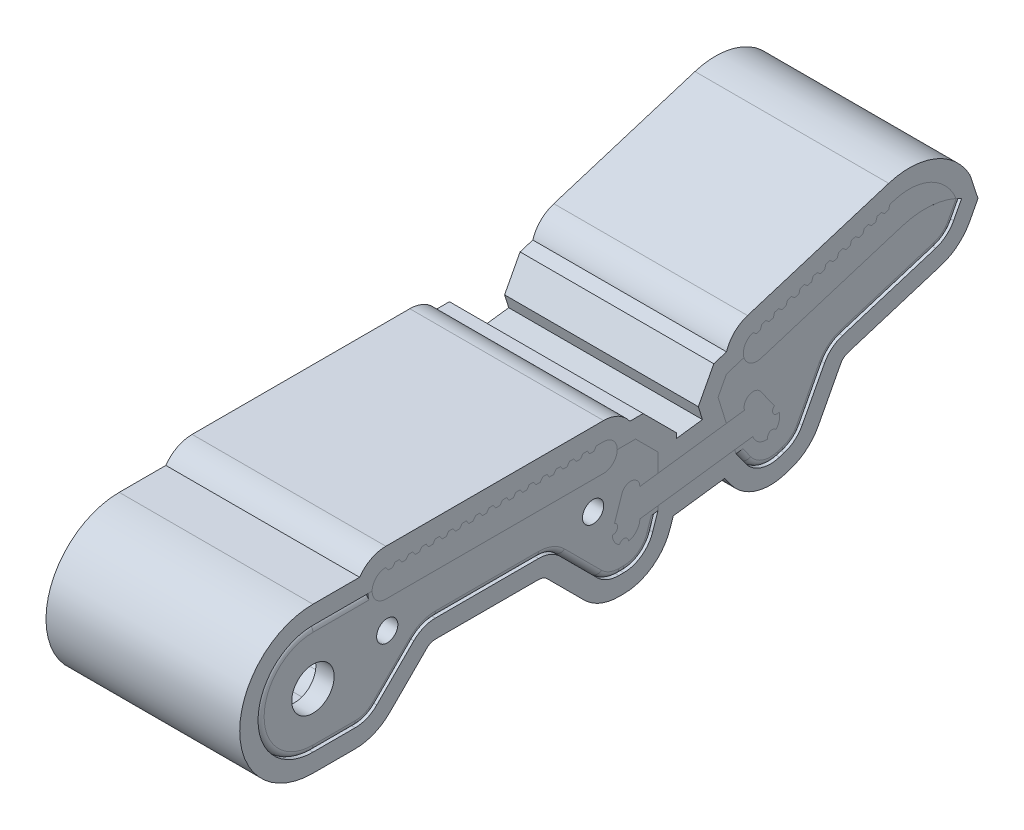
SolidWorks part; units mm, degrees
other "<finger_pivot>-<Wall Removal[2]>"
other "<finger_pivot>-<Wall Removal[1]>"
other "<finger_pivot>-<Pad Material[3]>"
other "<finger_pivot>-<Pad Material[2]>"
other "<finger_pivot>-<Pad Material[1]>"
ref_plane "Front Plane" through (0, 0, 0) normal (0, 0, 1) x (1, 0, 0)
ref_plane "Top Plane" through (0, 0, 0) normal (0, 1, 0) x (1, 0, 0)
ref_plane "Right Plane" through (0, 0, 0) normal (1, 0, 0) x (0, 0, -1)
inserted part "finger_pivot"
sketch "Sketch1" plane through (15.875, 0, 0) normal (1, 0, 0) x (0, 0, -1)
  line L0 (71.2277, 17.3552) -> (94.3613, 24.5492)
  line L1 (11.95, 14.25) -> (47.6241, 14.25)
  line L2 (107.6723, 19.1049) -> (108.9953, 15.0907)
  line L3 (106.3109, 16.4315) -> (108.9953, 15.0907) construction
  line L4 (108.9953, 15.0907) -> (107.6539, 12.5385)
  line L46 (73.4548, 10.1935) -> (96.5884, 17.3875)
  line L47 (95.2522, 21.6845) -> (94.5585, 21.4688)
  line L48 (94.5585, 21.4688) -> (94.3471, 20.8015)
  line L49 (94.3471, 20.8015) -> (93.6787, 20.5936)
  line L50 (93.6787, 20.5936) -> (93.1262, 21.0234)
  line L51 (93.1262, 21.0234) -> (92.4577, 20.8155)
  line L52 (92.4577, 20.8155) -> (92.2464, 20.1482)
  line L53 (92.2464, 20.1482) -> (91.5779, 19.9403)
  line L54 (91.5779, 19.9403) -> (91.0254, 20.3701)
  line L55 (91.0254, 20.3701) -> (90.357, 20.1622)
  line L56 (90.357, 20.1622) -> (90.1456, 19.4949)
  line L57 (90.1456, 19.4949) -> (89.4772, 19.2871)
  line L58 (89.4772, 19.2871) -> (88.9246, 19.7168)
  line L59 (7.6416, 12) -> (7.6416, 12)
  line L60 (88.9246, 19.7168) -> (88.2562, 19.509)
  line L61 (88.2562, 19.509) -> (88.0448, 18.8416)
  line L62 (88.0448, 18.8416) -> (87.3764, 18.6338)
  line L63 (87.3764, 18.6338) -> (86.8239, 19.0635)
  line L64 (86.8239, 19.0635) -> (86.1554, 18.8557)
  line L65 (56.5464, -3.0058) -> (56.5464, -2.2998) construction
  line L66 (7.6416, 12) -> (0, 12)
  line L67 (0, -12) -> (6.9289, -12)
  line L68 (12.5858, -9.6569) -> (18.6569, -3.5858)
  line L69 (56.5464, 2.2998) -> (56.5464, 5.3277) construction
  line L70 (56.5464, 5.3277) -> (52.8741, 9) construction
  line L71 (52.8741, 9) -> (49.8741, 9) construction
  line L72 (20.0711, -3) -> (36.9754, -3)
  line L73 (9.7, 9) -> (9, 9) construction
  line L74 (38.3896, -3.5858) -> (44.4606, -9.6569)
  line L75 (9, 9) -> (0, 9) construction
  line L76 (0, -9) -> (6.9289, -9) construction
  line L77 (10.4645, -7.5355) -> (16.5355, -1.4645) construction
  line L78 (20.0711, 0) -> (36.9754, 0) construction
  line L79 (40.5109, -1.4645) -> (46.582, -7.5355) construction
  line L80 (50.1175, -9) -> (50.9402, -9) construction
  line L81 (50.1175, -12) -> (50.9402, -12)
  line L82 (55.6812, -5.5884) -> (56.5464, -3.0058) construction
  line L83 (58.5258, -6.5414) -> (59.0432, -4.997)
  line L84 (70.731, 4.1672) -> (53.5721, 1.9082) construction
  line L85 (59.0432, -4.997) -> (59.0432, -4.997)
  line L86 (53.5721, -2.6914) -> (72.1051, -0.2514) construction
  line L87 (69.1308, -0.643) -> (69.3417, -1.3213) construction
  line L88 (59.0432, -4.997) -> (67.4895, -3.885)
  line L89 (105.4161, 16.8784) -> (105.4064, 16.8833) construction
  line L90 (67.4895, -3.885) -> (67.4895, -3.885)
  line L91 (70.6381, 11.6739) -> (67.7735, 10.783) construction
  line L92 (67.7735, 10.783) -> (66.3939, 8.1581) construction
  line L93 (66.3939, 8.1581) -> (67.7567, 3.7756) construction
  line L94 (67.4895, -3.885) -> (68.4762, -5.2588)
  line L95 (77.3495, -8.2311) -> (78.1282, -7.9889)
  line L96 (82.8341, -4.0717) -> (86.4934, 2.8908)
  line L97 (87.6699, 3.8701) -> (102.9481, 8.6213)
  line L98 (86.1554, 18.8557) -> (85.9441, 18.1883)
  line L99 (85.9441, 18.1883) -> (85.2756, 17.9805)
  line L100 (85.2756, 17.9805) -> (84.7231, 18.4102)
  line L101 (84.7231, 18.4102) -> (84.0547, 18.2024)
  line L102 (84.0547, 18.2024) -> (83.8433, 17.5351)
  line L103 (83.8433, 17.5351) -> (83.1749, 17.3272)
  line L104 (83.1749, 17.3272) -> (82.6223, 17.757)
  line L105 (82.6223, 17.757) -> (81.9539, 17.5491)
  line L106 (81.9539, 17.5491) -> (81.7425, 16.8818)
  line L107 (81.7425, 16.8818) -> (81.0741, 16.6739)
  line L108 (81.0741, 16.6739) -> (80.5216, 17.1037)
  line L109 (80.5216, 17.1037) -> (79.8531, 16.8958)
  line L110 (79.8531, 16.8958) -> (79.6418, 16.2285)
  line L111 (79.6418, 16.2285) -> (78.9733, 16.0206)
  line L112 (78.9733, 16.0206) -> (78.4208, 16.4504)
  line L113 (78.4208, 16.4504) -> (77.7524, 16.2425)
  line L114 (77.7524, 16.2425) -> (77.541, 15.5752)
  line L115 (77.541, 15.5752) -> (76.8726, 15.3673)
  line L116 (76.8726, 15.3673) -> (76.32, 15.7971)
  line L117 (76.32, 15.7971) -> (75.6516, 15.5892)
  line L118 (75.6516, 15.5892) -> (75.4402, 14.9219)
  line L119 (75.4402, 14.9219) -> (74.7718, 14.714)
  line L120 (74.7718, 14.714) -> (74.2193, 15.1438)
  line L121 (74.2193, 15.1438) -> (73.5509, 14.9359)
  line L122 (73.5509, 14.9359) -> (73.3395, 14.2686)
  line L123 (73.3395, 14.2686) -> (72.6711, 14.0607)
  line L124 (72.6711, 14.0607) -> (72.1185, 14.4905)
  line L126 (95.2522, 21.6845) -> (94.5585, 21.4688)
  line L127 (94.5585, 21.4688) -> (94.3471, 20.8015)
  line L128 (94.3471, 20.8015) -> (93.6787, 20.5936)
  line L129 (93.6787, 20.5936) -> (93.1262, 21.0234)
  line L130 (93.1262, 21.0234) -> (92.4577, 20.8155)
  line L131 (92.4577, 20.8155) -> (92.2464, 20.1482)
  line L132 (92.2464, 20.1482) -> (91.5779, 19.9403)
  line L133 (91.5779, 19.9403) -> (91.0254, 20.3701)
  line L134 (91.0254, 20.3701) -> (90.357, 20.1622)
  line L135 (90.357, 20.1622) -> (90.1456, 19.4949)
  line L136 (90.1456, 19.4949) -> (89.4772, 19.2871)
  line L137 (89.4772, 19.2871) -> (88.9246, 19.7168)
  line L138 (88.9246, 19.7168) -> (88.2562, 19.509)
  line L139 (88.2562, 19.509) -> (88.0448, 18.8416)
  line L140 (88.0448, 18.8416) -> (87.3764, 18.6338)
  line L141 (87.3764, 18.6338) -> (86.8239, 19.0635)
  line L142 (106.3109, 16.4315) -> (105.4161, 16.8784) construction
  line L143 (104.9984, 13.9342) -> (106.3109, 16.4315) construction
  line L144 (86.779, 6.7348) -> (102.0572, 11.486) construction
  line L146 (69.3417, -1.3213) -> (70.9128, -3.5087) construction
  line L147 (76.4586, -5.3664) -> (77.2373, -5.1242) construction
  line L148 (80.1785, -2.6759) -> (83.8378, 4.2865) construction
  line L150 (107.6723, 19.1049) -> (107.6723, 19.1049)
  line L151 (67.7817, 13.9273) -> (65.696, 13.2787)
  line L152 (65.696, 13.2787) -> (63.1602, 8.4538)
  line L153 (63.1602, 8.4538) -> (63.8346, 6.2852)
  line L154 (63.8346, 6.2852) -> (59.5464, 5.7206)
  line L155 (59.5464, 5.7206) -> (59.5464, 6.5703)
  line L156 (59.5464, 6.5703) -> (54.1167, 12)
  line L157 (54.1167, 12) -> (51.9325, 12)
  line L158 (86.8239, 19.0635) -> (86.1554, 18.8557)
  line L159 (86.1554, 18.8557) -> (85.9441, 18.1883)
  line L160 (85.9441, 18.1883) -> (85.2756, 17.9805)
  line L161 (85.2756, 17.9805) -> (84.7231, 18.4102)
  line L162 (84.7231, 18.4102) -> (84.0547, 18.2024)
  line L163 (84.0547, 18.2024) -> (83.8433, 17.5351)
  line L164 (83.8433, 17.5351) -> (83.1749, 17.3272)
  line L165 (83.1749, 17.3272) -> (82.6223, 17.757)
  line L166 (82.6223, 17.757) -> (81.9539, 17.5491)
  line L167 (81.9539, 17.5491) -> (81.7425, 16.8818)
  line L168 (81.7425, 16.8818) -> (81.0741, 16.6739)
  line L169 (81.0741, 16.6739) -> (80.5216, 17.1037)
  line L170 (80.5216, 17.1037) -> (79.8531, 16.8958)
  line L171 (79.8531, 16.8958) -> (79.6418, 16.2285)
  line L172 (79.6418, 16.2285) -> (78.9733, 16.0206)
  line L173 (78.9733, 16.0206) -> (78.4208, 16.4504)
  line L174 (78.4208, 16.4504) -> (77.7524, 16.2425)
  line L175 (77.7524, 16.2425) -> (77.541, 15.5752)
  line L176 (77.541, 15.5752) -> (76.8726, 15.3673)
  line L177 (76.8726, 15.3673) -> (76.32, 15.7971)
  line L178 (76.32, 15.7971) -> (75.6516, 15.5892)
  line L179 (75.6516, 15.5892) -> (75.4402, 14.9219)
  line L180 (75.4402, 14.9219) -> (74.7718, 14.714)
  line L181 (74.7718, 14.714) -> (74.2193, 15.1438)
  line L182 (74.2193, 15.1438) -> (73.5509, 14.9359)
  line L183 (73.5509, 14.9359) -> (73.3395, 14.2686)
  line L184 (73.3395, 14.2686) -> (72.6711, 14.0607)
  line L185 (72.6711, 14.0607) -> (72.1185, 14.4905)
  line L206 (44.25, 11.25) -> (43.85, 10.6755)
  line L207 (43.85, 10.6755) -> (43.15, 10.6755)
  line L208 (43.15, 10.6755) -> (42.75, 11.25)
  line L209 (42.75, 11.25) -> (42.05, 11.25)
  line L210 (42.05, 11.25) -> (41.65, 10.6755)
  line L211 (41.65, 10.6755) -> (40.95, 10.6755)
  line L212 (40.95, 10.6755) -> (40.55, 11.25)
  line L213 (40.55, 11.25) -> (39.85, 11.25)
  line L214 (56.5464, -3.0058) -> (56.5464, -2.2998)
  line L215 (39.85, 11.25) -> (39.45, 10.6755)
  line L216 (39.45, 10.6755) -> (38.75, 10.6755)
  line L217 (38.75, 10.6755) -> (38.35, 11.25)
  line L218 (56.5464, 2.2998) -> (56.5464, 5.3277)
  line L219 (56.5464, 5.3277) -> (52.8741, 9)
  line L220 (52.8741, 9) -> (49.8741, 9)
  line L221 (38.35, 11.25) -> (37.65, 11.25)
  line L222 (9.7, 9) -> (9, 9)
  line L223 (37.65, 11.25) -> (37.25, 10.6755)
  line L224 (9, 9) -> (0, 9)
  line L225 (0, -9) -> (6.9289, -9)
  line L226 (10.4645, -7.5355) -> (16.5355, -1.4645)
  line L227 (20.0711, 0) -> (36.9754, 0)
  line L228 (40.5109, -1.4645) -> (46.582, -7.5355)
  line L229 (50.1175, -9) -> (50.9402, -9)
  line L230 (37.25, 10.6755) -> (36.55, 10.6755)
  line L231 (55.6812, -5.5884) -> (56.5464, -3.0058)
  line L232 (36.55, 10.6755) -> (36.15, 11.25)
  line L233 (67.7567, 3.7756) -> (56.5464, 2.2998)
  line L234 (36.15, 11.25) -> (35.45, 11.25)
  line L235 (56.5464, -2.2998) -> (69.1308, -0.643)
  line L236 (69.1308, -0.643) -> (69.3417, -1.3213)
  line L237 (35.45, 11.25) -> (35.05, 10.6755)
  line L238 (105.4161, 16.8784) -> (105.4064, 16.8833)
  line L239 (35.05, 10.6755) -> (34.35, 10.6755)
  line L240 (70.6381, 11.6739) -> (67.7735, 10.783)
  line L241 (67.7735, 10.783) -> (66.3939, 8.1581)
  line L242 (66.3939, 8.1581) -> (67.7567, 3.7756)
  line L243 (34.35, 10.6755) -> (33.95, 11.25)
  line L244 (33.95, 11.25) -> (33.25, 11.25)
  line L245 (33.25, 11.25) -> (32.85, 10.6755)
  line L246 (32.85, 10.6755) -> (32.15, 10.6755)
  line L247 (32.15, 10.6755) -> (31.75, 11.25)
  line L248 (31.75, 11.25) -> (31.05, 11.25)
  line L249 (31.05, 11.25) -> (30.65, 10.6755)
  line L250 (30.65, 10.6755) -> (29.95, 10.6755)
  line L251 (29.95, 10.6755) -> (29.55, 11.25)
  line L252 (29.55, 11.25) -> (28.85, 11.25)
  line L253 (28.85, 11.25) -> (28.45, 10.6755)
  line L254 (28.45, 10.6755) -> (27.75, 10.6755)
  line L255 (27.75, 10.6755) -> (27.35, 11.25)
  line L256 (27.35, 11.25) -> (26.65, 11.25)
  line L257 (26.65, 11.25) -> (26.25, 10.6755)
  line L258 (26.25, 10.6755) -> (25.55, 10.6755)
  line L259 (25.55, 10.6755) -> (25.15, 11.25)
  line L260 (25.15, 11.25) -> (24.45, 11.25)
  line L261 (24.45, 11.25) -> (24.05, 10.6755)
  line L262 (24.05, 10.6755) -> (23.35, 10.6755)
  line L263 (23.35, 10.6755) -> (22.95, 11.25)
  line L264 (22.95, 11.25) -> (22.25, 11.25)
  line L265 (22.25, 11.25) -> (21.85, 10.6755)
  line L266 (21.85, 10.6755) -> (21.15, 10.6755)
  line L267 (21.15, 10.6755) -> (20.75, 11.25)
  line L268 (20.75, 11.25) -> (20.05, 11.25)
  line L269 (20.05, 11.25) -> (19.65, 10.6755)
  line L270 (19.65, 10.6755) -> (18.95, 10.6755)
  line L271 (18.95, 10.6755) -> (18.55, 11.25)
  line L272 (18.55, 11.25) -> (17.85, 11.25)
  line L273 (17.85, 11.25) -> (17.45, 10.6755)
  line L274 (17.45, 10.6755) -> (16.75, 10.6755)
  line L275 (16.75, 10.6755) -> (16.35, 11.25)
  line L276 (16.35, 11.25) -> (15.65, 11.25)
  line L277 (15.65, 11.25) -> (15.25, 10.6755)
  line L278 (15.25, 10.6755) -> (14.55, 10.6755)
  line L279 (14.55, 10.6755) -> (14.15, 11.25)
  line L280 (14.15, 11.25) -> (13.45, 11.25)
  line L281 (13.45, 11.25) -> (13.05, 10.6755)
  line L282 (13.05, 10.6755) -> (12.35, 10.6755)
  line L283 (12.35, 10.6755) -> (11.95, 11.25)
  line L284 (11.95, 6.75) -> (47.6241, 6.75)
  line L285 (47.6241, 11.25) -> (46.45, 11.25)
  line L286 (46.45, 11.25) -> (46.05, 10.6755)
  line L287 (46.05, 10.6755) -> (45.35, 10.6755)
  line L288 (45.35, 10.6755) -> (44.95, 11.25)
  line L289 (44.95, 11.25) -> (44.25, 11.25)
  line L290 (44.25, 11.25) -> (43.85, 10.6755)
  line L291 (106.3109, 16.4315) -> (105.4161, 16.8784)
  line L292 (104.9984, 13.9342) -> (106.3109, 16.4315)
  line L293 (86.779, 6.7348) -> (102.0572, 11.486)
  line L294 (43.85, 10.6755) -> (43.15, 10.6755)
  line L295 (69.3417, -1.3213) -> (70.9128, -3.5087)
  line L296 (76.4586, -5.3664) -> (77.2373, -5.1242)
  line L297 (80.1785, -2.6759) -> (83.8378, 4.2865)
  line L298 (43.15, 10.6755) -> (42.75, 11.25)
  line L299 (42.75, 11.25) -> (42.05, 11.25)
  line L300 (42.05, 11.25) -> (41.65, 10.6755)
  line L301 (41.65, 10.6755) -> (40.95, 10.6755)
  line L302 (40.95, 10.6755) -> (40.55, 11.25)
  line L303 (40.55, 11.25) -> (39.85, 11.25)
  line L304 (39.85, 11.25) -> (39.45, 10.6755)
  line L305 (39.45, 10.6755) -> (38.75, 10.6755)
  line L306 (38.75, 10.6755) -> (38.35, 11.25)
  line L307 (38.35, 11.25) -> (37.65, 11.25)
  line L308 (37.65, 11.25) -> (37.25, 10.6755)
  line L309 (37.25, 10.6755) -> (36.55, 10.6755)
  line L310 (36.55, 10.6755) -> (36.15, 11.25)
  line L311 (36.15, 11.25) -> (35.45, 11.25)
  line L312 (35.45, 11.25) -> (35.05, 10.6755)
  line L313 (35.05, 10.6755) -> (34.35, 10.6755)
  line L314 (34.35, 10.6755) -> (33.95, 11.25)
  line L315 (33.95, 11.25) -> (33.25, 11.25)
  line L316 (33.25, 11.25) -> (32.85, 10.6755)
  line L317 (32.85, 10.6755) -> (32.15, 10.6755)
  line L318 (32.15, 10.6755) -> (31.75, 11.25)
  line L319 (31.75, 11.25) -> (31.05, 11.25)
  line L320 (31.05, 11.25) -> (30.65, 10.6755)
  line L321 (30.65, 10.6755) -> (29.95, 10.6755)
  line L322 (29.95, 10.6755) -> (29.55, 11.25)
  line L323 (29.55, 11.25) -> (28.85, 11.25)
  line L324 (28.85, 11.25) -> (28.45, 10.6755)
  line L325 (28.45, 10.6755) -> (27.75, 10.6755)
  line L326 (27.75, 10.6755) -> (27.35, 11.25)
  line L327 (27.35, 11.25) -> (26.65, 11.25)
  line L328 (26.65, 11.25) -> (26.25, 10.6755)
  line L329 (26.25, 10.6755) -> (25.55, 10.6755)
  line L330 (25.55, 10.6755) -> (25.15, 11.25)
  line L331 (25.15, 11.25) -> (24.45, 11.25)
  line L332 (24.45, 11.25) -> (24.05, 10.6755)
  line L333 (24.05, 10.6755) -> (23.35, 10.6755)
  line L334 (23.35, 10.6755) -> (22.95, 11.25)
  line L335 (22.95, 11.25) -> (22.25, 11.25)
  line L336 (22.25, 11.25) -> (21.85, 10.6755)
  line L337 (21.85, 10.6755) -> (21.15, 10.6755)
  line L338 (21.15, 10.6755) -> (20.75, 11.25)
  line L339 (20.75, 11.25) -> (20.05, 11.25)
  line L340 (20.05, 11.25) -> (19.65, 10.6755)
  line L341 (19.65, 10.6755) -> (18.95, 10.6755)
  line L342 (18.95, 10.6755) -> (18.55, 11.25)
  line L343 (18.55, 11.25) -> (17.85, 11.25)
  line L344 (17.85, 11.25) -> (17.45, 10.6755)
  line L345 (17.45, 10.6755) -> (16.75, 10.6755)
  line L346 (16.75, 10.6755) -> (16.35, 11.25)
  line L347 (16.35, 11.25) -> (15.65, 11.25)
  line L348 (15.65, 11.25) -> (15.25, 10.6755)
  line L349 (15.25, 10.6755) -> (14.55, 10.6755)
  line L350 (14.55, 10.6755) -> (14.15, 11.25)
  line L351 (14.15, 11.25) -> (13.45, 11.25)
  line L352 (13.45, 11.25) -> (13.05, 10.6755)
  line L353 (13.05, 10.6755) -> (12.35, 10.6755)
  line L354 (12.35, 10.6755) -> (11.95, 11.25)
  line L356 (47.6241, 11.25) -> (46.45, 11.25)
  line L357 (46.45, 11.25) -> (46.05, 10.6755)
  line L358 (46.05, 10.6755) -> (45.35, 10.6755)
  line L359 (45.35, 10.6755) -> (44.95, 11.25)
  line L360 (44.95, 11.25) -> (44.25, 11.25)
  line L361 (110.3913, 17.7468) -> (107.6723, 19.1049) construction
  line L362 (107.6539, 12.5385) -> (110.3913, 17.7468) construction
  arc A0 (11.95, 14.25) -> (7.6416, 12) centre (11.95, 9) ccw
  arc A1 (0, 12) -> (0, -12) centre (0, 0) ccw
  arc A2 (11.95, 11.25) -> (11.95, 6.75) centre (11.95, 9) ccw construction
  arc A3 (47.6241, 6.75) -> (47.6241, 11.25) centre (47.6241, 9) ccw construction
  arc A4 (6.9289, -12) -> (12.5858, -9.6569) centre (6.9289, -4) ccw
  arc A5 (20.0711, -3) -> (18.6569, -3.5858) centre (20.0711, -5) ccw
  arc A6 (38.3896, -3.5858) -> (36.9754, -3) centre (36.9754, -5) ccw
  arc A7 (44.4606, -9.6569) -> (50.1175, -12) centre (50.1175, -4) ccw
  arc A8 (50.9402, -12) -> (58.5258, -6.5414) centre (50.9402, -4) ccw
  arc A9 (68.4762, -5.2588) -> (77.3495, -8.2311) centre (74.9739, -0.5919) ccw
  arc A10 (78.1282, -7.9889) -> (82.8341, -4.0717) centre (75.7526, -0.3498) ccw
  arc A11 (87.6699, 3.8701) -> (86.4934, 2.8908) centre (88.2638, 1.9603) ccw
  arc A12 (102.9481, 8.6213) -> (107.6539, 12.5385) centre (100.5725, 16.2604) ccw
  arc A13 (0, 9) -> (0, -9) centre (0, 0) ccw construction
  arc A14 (6.9289, -9) -> (10.4645, -7.5355) centre (6.9289, -4) ccw construction
  arc A15 (20.0711, 0) -> (16.5355, -1.4645) centre (20.0711, -5) ccw construction
  arc A16 (40.5109, -1.4645) -> (36.9754, 0) centre (36.9754, -5) ccw construction
  arc A17 (46.582, -7.5355) -> (50.1175, -9) centre (50.1175, -4) ccw construction
  arc A18 (50.9402, -9) -> (55.6812, -5.5884) centre (50.9402, -4) ccw construction
  arc A19 (107.6723, 19.1049) -> (94.3613, 24.5492) centre (97.7168, 13.7589) ccw
  arc A20 (71.2277, 17.3552) -> (67.7817, 13.9273) centre (72.7866, 12.342) ccw
  arc A21 (51.9325, 12) -> (47.6241, 14.25) centre (47.6241, 9) ccw
  arc A24 (11.95, 11.25) -> (11.95, 6.75) centre (11.95, 9) ccw
  arc A25 (72.1185, 14.4905) -> (73.4548, 10.1935) centre (72.7866, 12.342) ccw
  arc A26 (105.4064, 16.8833) -> (96.5884, 17.3875) centre (100.3247, 5.3728) ccw
  arc A27 (105.4064, 16.8833) -> (95.2522, 21.6845) centre (97.7168, 13.7589) ccw
  arc A28 (72.1185, 14.4905) -> (70.6381, 11.6739) centre (72.7866, 12.342) ccw
  arc A30 (105.4064, 16.8833) -> (95.2522, 21.6845) centre (97.7168, 13.7589) ccw
  arc A31 (47.6241, 6.75) -> (47.6241, 11.25) centre (47.6241, 9) ccw
  arc A32 (11.95, 11.25) -> (9.7, 9) centre (11.95, 9) ccw
  arc A33 (49.8741, 9) -> (47.6241, 11.25) centre (47.6241, 9) ccw
  arc A36 (72.1185, 14.4905) -> (73.4548, 10.1935) centre (72.7866, 12.342) ccw construction
  arc A38 (105.4064, 16.8833) -> (95.2522, 21.6845) centre (97.7168, 13.7589) ccw construction
  arc A39 (102.0572, 11.486) -> (104.9984, 13.9342) centre (100.5725, 16.2604) ccw construction
  arc A40 (70.9128, -3.5087) -> (76.4586, -5.3664) centre (74.9739, -0.5919) ccw construction
  arc A41 (77.2373, -5.1242) -> (80.1785, -2.6759) centre (75.7526, -0.3498) ccw construction
  arc A42 (86.779, 6.7348) -> (83.8378, 4.2865) centre (88.2638, 1.9603) ccw construction
  arc A43 (11.95, 11.25) -> (9.7, 9) centre (11.95, 9) ccw
  arc A44 (49.8741, 9) -> (47.6241, 11.25) centre (47.6241, 9) ccw
  arc A54 (0, 9) -> (0, -9) centre (0, 0) ccw
  arc A55 (6.9289, -9) -> (10.4645, -7.5355) centre (6.9289, -4) ccw
  arc A56 (20.0711, 0) -> (16.5355, -1.4645) centre (20.0711, -5) ccw
  arc A57 (40.5109, -1.4645) -> (36.9754, 0) centre (36.9754, -5) ccw
  arc A58 (46.582, -7.5355) -> (50.1175, -9) centre (50.1175, -4) ccw
  arc A59 (50.9402, -9) -> (55.6812, -5.5884) centre (50.9402, -4) ccw
  arc A77 (72.1185, 14.4905) -> (70.6381, 11.6739) centre (72.7866, 12.342) ccw
  arc A79 (105.4064, 16.8833) -> (95.2522, 21.6845) centre (97.7168, 13.7589) ccw
  arc A80 (102.0572, 11.486) -> (104.9984, 13.9342) centre (100.5725, 16.2604) ccw
  arc A81 (70.9128, -3.5087) -> (76.4586, -5.3664) centre (74.9739, -0.5919) ccw
  arc A82 (77.2373, -5.1242) -> (80.1785, -2.6759) centre (75.7526, -0.3498) ccw
  arc A83 (86.779, 6.7348) -> (83.8378, 4.2865) centre (88.2638, 1.9603) ccw
  dimension "D3" = 0
  dimension "D2" = 0
  dimension "D1" = 3
extrude "Outer Shell" add sketch "Sketch1" against normal up to surface (31.75 mm away) separate body
sketch "Sketch2" plane through (0, -3, 0) normal (0, -1, 0) x (1, 0, 0)
  line L1 (15.875, -20.0711) -> (15.875, -36.9754) construction
  line L2 (-15.875, -20.0711) -> (15.875, -20.0711) construction
  line L3 (-15.875, -36.9754) -> (-15.875, -20.0711) construction
  line L4 (-15.875, -36.9754) -> (15.875, -36.9754) construction
  line L8 (15.875, -20.0711) -> (15.875, -36.9754) construction
  line L9 (-15.875, -20.0711) -> (15.875, -20.0711) construction
  line L10 (-15.875, -36.9754) -> (-15.875, -20.0711) construction
  line L11 (-15.875, -36.9754) -> (15.875, -36.9754) construction
  line L12 (12.875, -23.0711) -> (12.875, -33.9754)
  line L13 (-12.875, -33.9754) -> (12.875, -33.9754)
  line L14 (-12.875, -33.9754) -> (-12.875, -23.0711)
  line L15 (-12.875, -23.0711) -> (12.875, -23.0711)
  dimension "D1" = 3
extrude "Back Cut 1" cut sketch "Sketch2" against normal up to surface (3 mm away)
sketch "Sketch3" plane through (0, -21.3304, -6.6333) normal (0, -0.9549, -0.2969) x (1, 0, 0)
  line L1 (-15.875, -84.8646) -> (15.875, -84.8646) construction
  line L2 (15.875, -84.8646) -> (15.875, -100.8645) construction
  line L3 (-15.875, -100.8645) -> (15.875, -100.8645) construction
  line L4 (-15.875, -100.8645) -> (-15.875, -84.8646) construction
  line L8 (-15.875, -84.8646) -> (15.875, -84.8646) construction
  line L9 (15.875, -84.8646) -> (15.875, -100.8645) construction
  line L10 (-15.875, -100.8645) -> (15.875, -100.8645) construction
  line L11 (-15.875, -100.8645) -> (-15.875, -84.8646) construction
  line L12 (-12.875, -87.8646) -> (12.875, -87.8646)
  line L13 (12.875, -87.8646) -> (12.875, -97.8645)
  line L14 (-12.875, -97.8645) -> (12.875, -97.8645)
  line L15 (-12.875, -97.8645) -> (-12.875, -87.8646)
  dimension "D1" = 3
extrude "Back Cut 2" cut sketch "Sketch3" against normal up to surface (3 mm away)
fillet "Contouring" radius 2 8 edges at (-12.875, 9.1628, -99.638) (-12.875, 6.1933, -90.0891) (12.875, 9.1628, -99.638) (12.875, 6.1933, -90.0891) (12.875, -1.5, -23.0711) (12.875, -1.5, -33.9754) (-12.875, -1.5, -33.9754) (-12.875, -1.5, -23.0711)
equation "\"D1@Sketch1\"=\"width keep@values@params_print.sldprt\""
equation "\"D1@Sketch2\"=\"width keep@values@params_print.sldprt\""
equation "\"D1@Sketch3\"=\"width keep@values@params_print.sldprt\""
